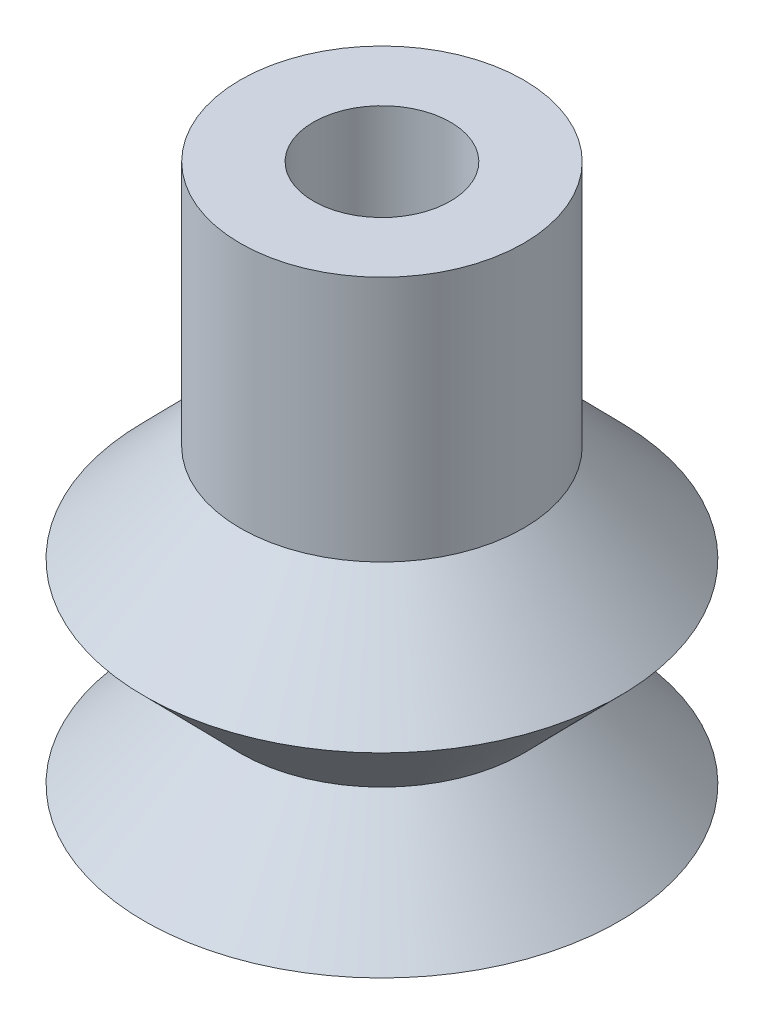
SolidWorks part; units mm, degrees
ref_plane "Front" through (0, 0, 0) normal (0, 0, 1) x (1, 0, 0)
ref_plane "Top" through (0, 0, 0) normal (0, 1, 0) x (1, 0, 0)
ref_plane "Right" through (0, 0, 0) normal (1, 0, 0) x (0, 0, -1)
sketch "Sketch1" plane through (0, 0, 0) normal (0, 0, 1) x (1, 0, 0)
  line L0 (0, 14.986) -> (0, 0) construction
  line L1 (1.905, 14.986) -> (1.905, 8.128)
  line L2 (1.905, 8.128) -> (3.937, 8.128) construction
  line L3 (3.937, 8.128) -> (6.604, 5.4187)
  line L4 (6.604, 5.4187) -> (3.937, 2.7093)
  line L14 (3.937, 8.128) -> (3.937, 14.986)
  line L15 (3.937, 14.986) -> (1.905, 14.986)
  line L17 (3.937, 2.7093) -> (6.604, 0)
  line L18 (6.604, 0) -> (4.572, 0)
  line L19 (4.572, 0) -> (1.905, 2.7093)
  line L30 (1.905, 2.7093) -> (4.572, 5.4187)
  line L31 (4.572, 5.4187) -> (1.905, 8.128)
  line L32 (4.572, 5.4187) -> (6.604, 5.4187) construction
  line L43 (3.937, 2.7093) -> (1.905, 2.7093) construction
  point P4 (0, 10.16)
  dimension "D" = 7.874
  dimension "Overall Height" = 14.986
  dimension "Mounting Stem ID" = 3.81
  dimension "C" = 8.128
  dimension "Lip Dia" = 13.208
  dimension "Compressed Cup Height" = 10.16
revolve "Revolve1" add sketch "Sketch1" angle 360 about L0
